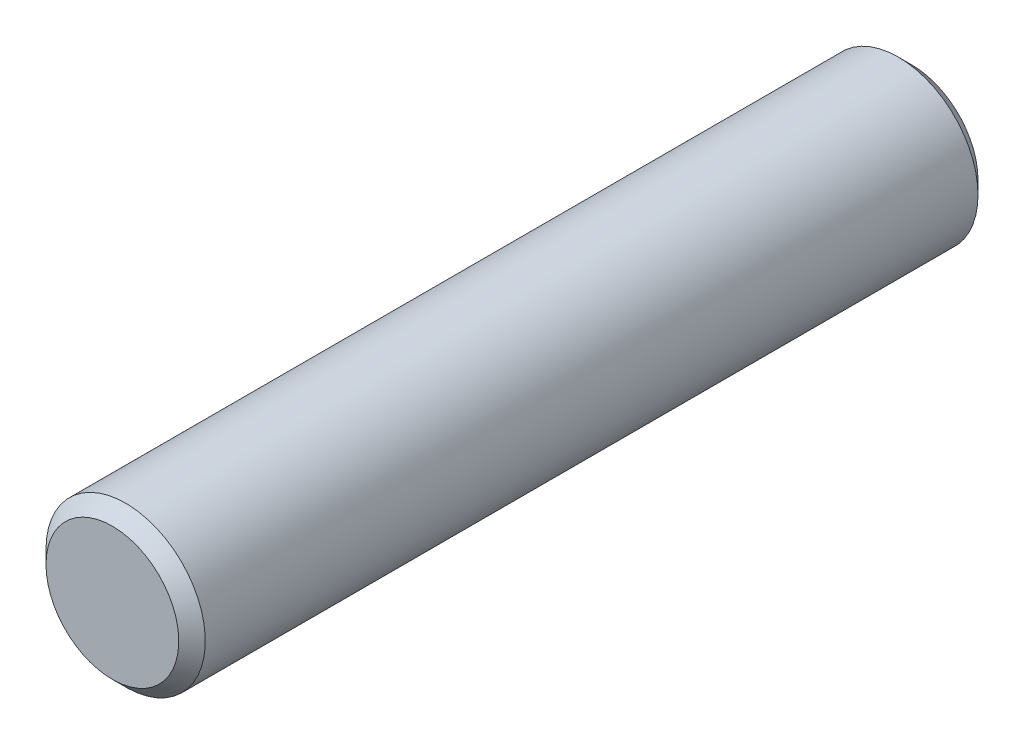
SolidWorks part; units mm, degrees
ref_plane "XZ (Face)" through (0, 0, 0) normal (0, 0, 1) x (1, 0, 0)
ref_plane "XY (Dessus)" through (0, 0, 0) normal (0, 1, 0) x (1, 0, 0)
ref_plane "YZ (Droite)" through (0, 0, 0) normal (1, 0, 0) x (0, 0, -1)
sketch "Esquisse1" plane through (0, 0, 0) normal (0, 0, 1) x (1, 0, 0)
  circle A0 centre (0, 15) radius 1.5 construction
  circle A1 centre (0, 15) radius 1.5
extrude "Base-Extrusion" add sketch "Esquisse1" along normal up to surface (11.65 mm away) and the other way offset from surface (3.4 mm away) 1
chamfer "Chanfrein1" distance 0.25 angle 45 2 edges at (-1.5, 15, 11.65) (1.5, 15, -3.4)
